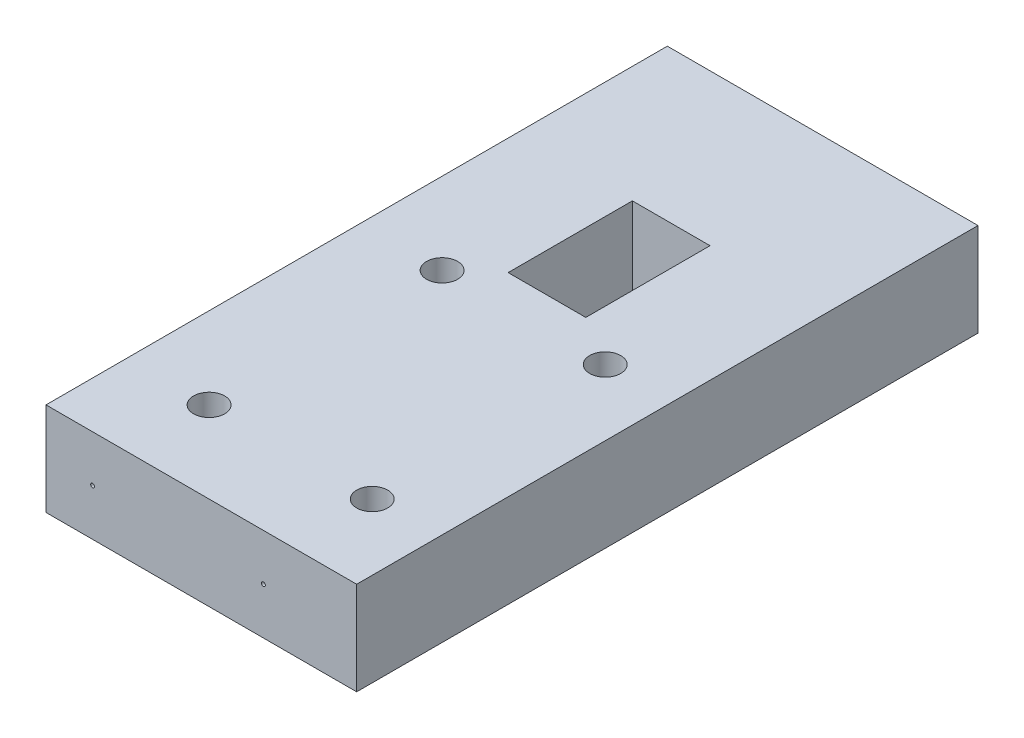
SolidWorks part; units mm, degrees
ref_plane "Front Plane" through (0, 0, 0) normal (0, 0, 1) x (1, 0, 0)
ref_plane "Top Plane" through (0, 0, 0) normal (0, 1, 0) x (1, 0, 0)
ref_plane "Right Plane" through (0, 0, 0) normal (1, 0, 0) x (0, 0, -1)
sketch "Sketch1" plane through (0, 0, 0) normal (0, 1, 0) x (1, 0, 0)
  line L0 (122.2375, 39.6875) -> (-182.5625, 39.6875) construction
  line L1 (-63.5, 127) -> (63.5, 127)
  line L2 (-63.5, 127) -> (-63.5, -127)
  line L3 (-63.5, -127) -> (63.5, -127)
  line L4 (63.5, 127) -> (63.5, -127)
  line L5 (-63.5, 127) -> (63.5, -127) construction
  line L6 (-63.5, -127) -> (63.5, 127) construction
  line L7 (-15.875, 65.0875) -> (15.875, 65.0875)
  line L8 (-15.875, 65.0875) -> (-15.875, 14.2875)
  line L9 (-15.875, 14.2875) -> (15.875, 14.2875)
  line L10 (15.875, 65.0875) -> (15.875, 14.2875)
  line L11 (15.875, 51.917) -> (15.875, 33.6705) construction
  point P0 (0, 0)
  dimension "D1" = 127
  dimension "D2" = 254
  dimension "D3" = 50.8
  dimension "D4" = 31.75
  dimension "D5" = 25.4
  dimension "D6" = 0
extrude "Boss-Extrude1" add sketch "Sketch1" along normal blind 38.1
hole_wizard "1/2 (0.5) Diameter Hole1" positions "Sketch8" profile "Sketch9" hole size "1/2" standard "ANSI Inch"
sketch "Sketch8" plane through (0, 38.1, 0) normal (0, 1, 0) x (1, 0, 0)
  line L0 (-63.5, 127) -> (-63.5, -127) construction
  line L1 (-63.5, -127) -> (63.5, -127) construction
  point P0 (-30.1625, 1.5875)
  point P2 (-30.1625, -93.6625)
  point P4 (36.5125, 1.5875)
  point P6 (36.5125, -93.6625)
  dimension "D1" = 33.3375
  dimension "D2" = 33.3375
  dimension "D3" = 95.25
  dimension "D4" = 66.675
sketch "Sketch9" plane through (-30.1625, 38.1, -1.5875) normal (1, 0, 0) x (0, 0, 1)
  line L0 (0, 0) -> (0, 38.1)
  line L1 (0, 38.1) -> (6.35, 38.1)
  line L2 (6.35, 38.1) -> (6.35, 0)
  line L5 (6.35, 0) -> (0, 0)
  line L11 (0, -6.35) -> (0, 107.95) construction
  dimension "Thru Hole Dia." = 12.7
  dimension "Thru Hole Depth" = 38.1
hole_wizard "1/16 (0.0625) Diameter Hole3" positions "Sketch11" profile "Sketch12" hole size "1/16" standard "ANSI Inch"
sketch "Sketch11" plane through (0, 0, 127) normal (0, 0, 1) x (1, 0, 0)
  line L0 (63.5, 38.1) -> (63.5, 0) construction
  point P0 (-44.45, 19.05)
  point P2 (25.4, 19.05)
  dimension "D1" = 69.85
  dimension "D2" = 38.1
  dimension "D3" = 19.05
sketch "Sketch12" plane through (-44.45, 19.05, 127) normal (1, 0, 0) x (0, -1, 0)
  line L0 (0, 0) -> (0, 38.5769)
  line L1 (0, 38.5769) -> (0.7937, 38.1)
  line L2 (0.7937, 38.1) -> (0.7937, 0)
  line L5 (0.7937, 0) -> (0, 0)
  line L10 (0, 38.5769) -> (-0.7937, 38.1) construction
  line L11 (0, -6.35) -> (0, 107.95) construction
  dimension "Hole Dia." = 1.5875
  dimension "Hole Depth" = 38.1
  dimension "Drill Angle" = 118
hole_wizard "1/16 (0.0625) Diameter Hole4" positions "Sketch13" profile "Sketch14" hole size "1/16" standard "ANSI Inch"
sketch "Sketch13" plane through (0, 0, -127) normal (0, 0, -1) x (-1, 0, 0)
  line L0 (-63.5, 38.1) -> (-63.5, 0) construction
  point P0 (-25.4, 19.05)
  point P2 (44.45, 19.05)
  dimension "D1" = 69.85
  dimension "D2" = 38.1
  dimension "D3" = 19.05
sketch "Sketch14" plane through (25.4, 19.05, -127) normal (1, 0, 0) x (0, 1, 0)
  line L0 (0, 0) -> (0, 38.5769)
  line L1 (0, 38.5769) -> (0.7937, 38.1)
  line L2 (0.7937, 38.1) -> (0.7937, 0)
  line L5 (0.7937, 0) -> (0, 0)
  line L10 (0, 38.5769) -> (-0.7938, 38.1) construction
  line L11 (0, -6.35) -> (0, 107.95) construction
  dimension "Hole Dia." = 1.5875
  dimension "Hole Depth" = 38.1
  dimension "Drill Angle" = 118
